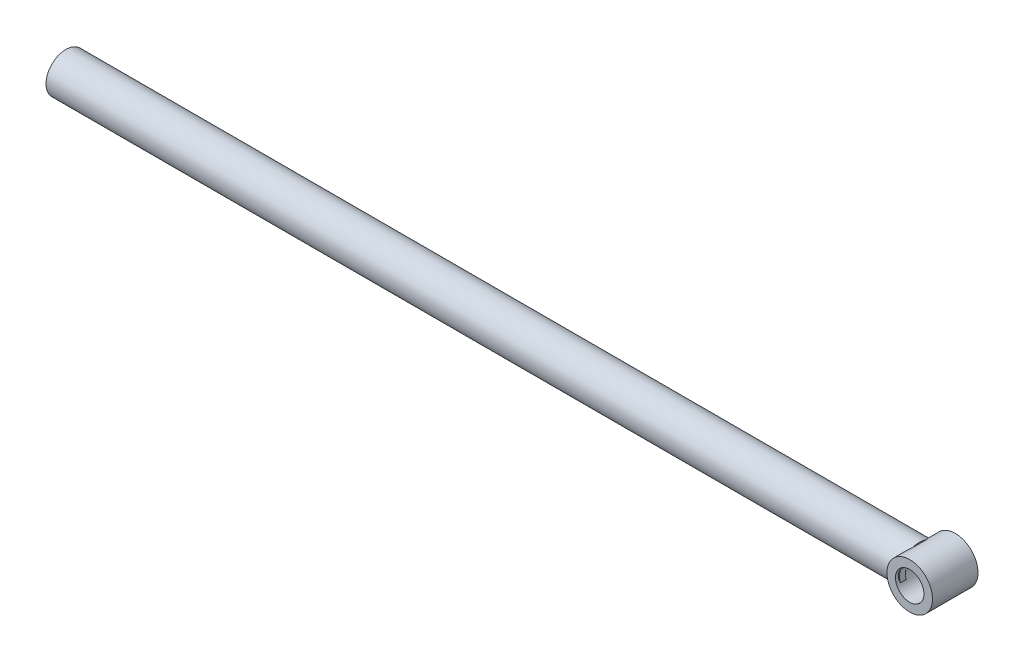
SolidWorks part; units mm, degrees
ref_plane "Face" through (0, 0, 0) normal (0, 0, 1) x (1, 0, 0)
ref_plane "Dessus" through (0, 0, 0) normal (0, 1, 0) x (1, 0, 0)
ref_plane "Droite" through (0, 0, 0) normal (1, 0, 0) x (0, 0, -1)
sketch "Esquisse1" plane through (0, 0, 0) normal (0, 0, 1) x (1, 0, 0)
  line L0 (50, 0) -> (-50, 0) construction
  circle A1 centre (282.8393, 0) radius 8
  circle A3 centre (282.8393, 0) radius 5
  dimension "D3" = 16
  dimension "D4" = 10
extrude "Extrusion1" add sketch "Esquisse1" along normal blind 16
sketch "Esquisse3" plane through (0, 0, 0) normal (0, 1, 0) x (1, 0, 0)
  line L0 (-116.6346, -8) -> (271.0658, -8) construction
  line L1 (-21.7323, -3) -> (278.2677, -3)
  line L2 (-21.7323, -1) -> (278.2677, -1)
  line L3 (-21.7323, -1) -> (-21.7323, -3)
  line L4 (278.2677, -1) -> (278.2677, -3)
  line L6 (287.8393, 0) -> (277.8393, 0) construction
  dimension "D1" = 10
  dimension "D2" = 14
  dimension "D3" = 8
  dimension "D4" = 300
revolve "Révolution3" add sketch "Esquisse3" angle 360 about L0
